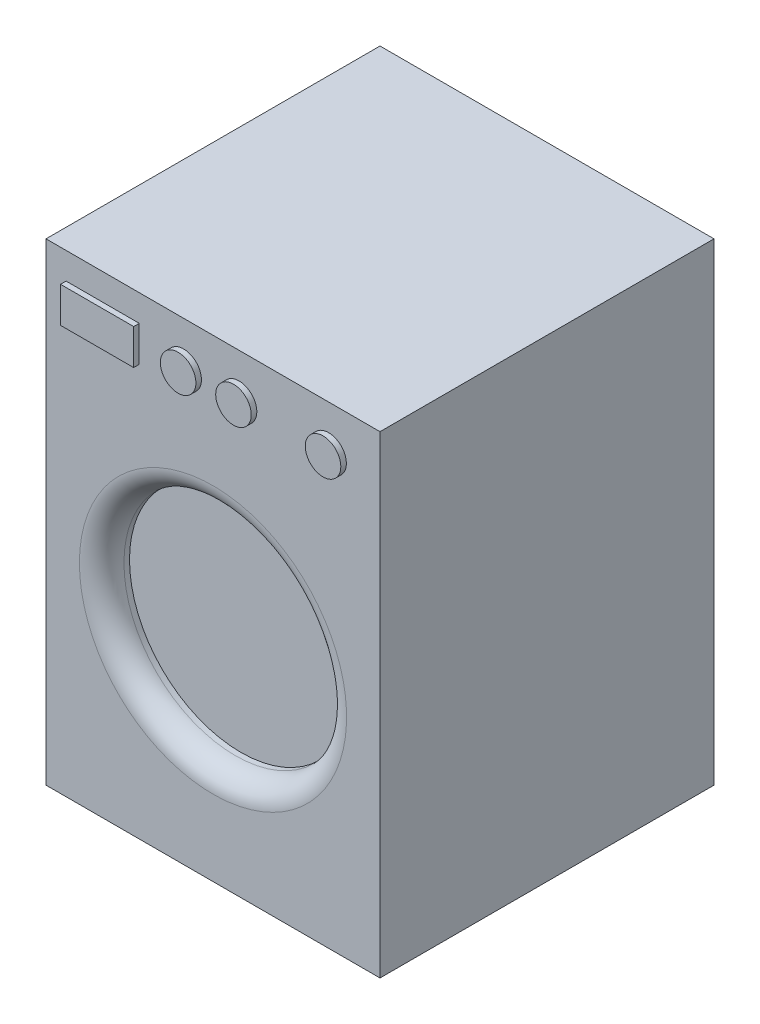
SolidWorks part; units mm, degrees
ref_plane "Plan de face" through (0, 0, 0) normal (0, 0, 1) x (1, 0, 0)
ref_plane "Plan de dessus" through (0, 0, 0) normal (0, 1, 0) x (1, 0, 0)
ref_plane "Plan de droite" through (0, 0, 0) normal (1, 0, 0) x (0, 0, -1)
sketch "Esquisse1" plane through (0, 0, 0) normal (0, 1, 0) x (1, 0, 0)
  line L1 (300, -300) -> (-300, -300)
  line L2 (300, -300) -> (300, 300)
  line L3 (300, 300) -> (-300, 300)
  line L4 (-300, -300) -> (-300, 300)
  line L5 (300, -300) -> (-300, 300) construction
  line L6 (300, 300) -> (-300, -300) construction
  point P0 (0, 0)
  dimension "D1" = 600
  dimension "D2" = 600
extrude "Boss.-Extru.1" add sketch "Esquisse1" along normal blind 850
sketch "Esquisse2" plane through (0, 0, 300) normal (0, 0, 1) x (1, 0, 0)
  circle A0 centre (0, 375.9775) radius 200
  dimension "D1" = 400
extrude "Enlèv. mat.-Extru.1" cut sketch "Esquisse2" against normal blind 50
fillet "Congé1" radius 40 1 edges at (200, 375.9775, 300)
sketch "Esquisse3" plane through (0, 0, 300) normal (0, 0, 1) x (1, 0, 0)
  line L1 (-263.9272, 802.286) -> (-132.525, 802.286)
  line L2 (-263.9272, 802.286) -> (-263.9272, 738.427)
  line L3 (-263.9272, 738.427) -> (-132.525, 738.427)
  line L4 (-132.525, 802.286) -> (-132.525, 738.427)
  circle A0 centre (-52.7012, 770.3565) radius 31.9295
  circle A1 centre (46.7714, 770.3565) radius 31.9295
  circle A2 centre (207.647, 770.3565) radius 31.9295
extrude "Boss.-Extru.2" add sketch "Esquisse3" along normal blind 10
